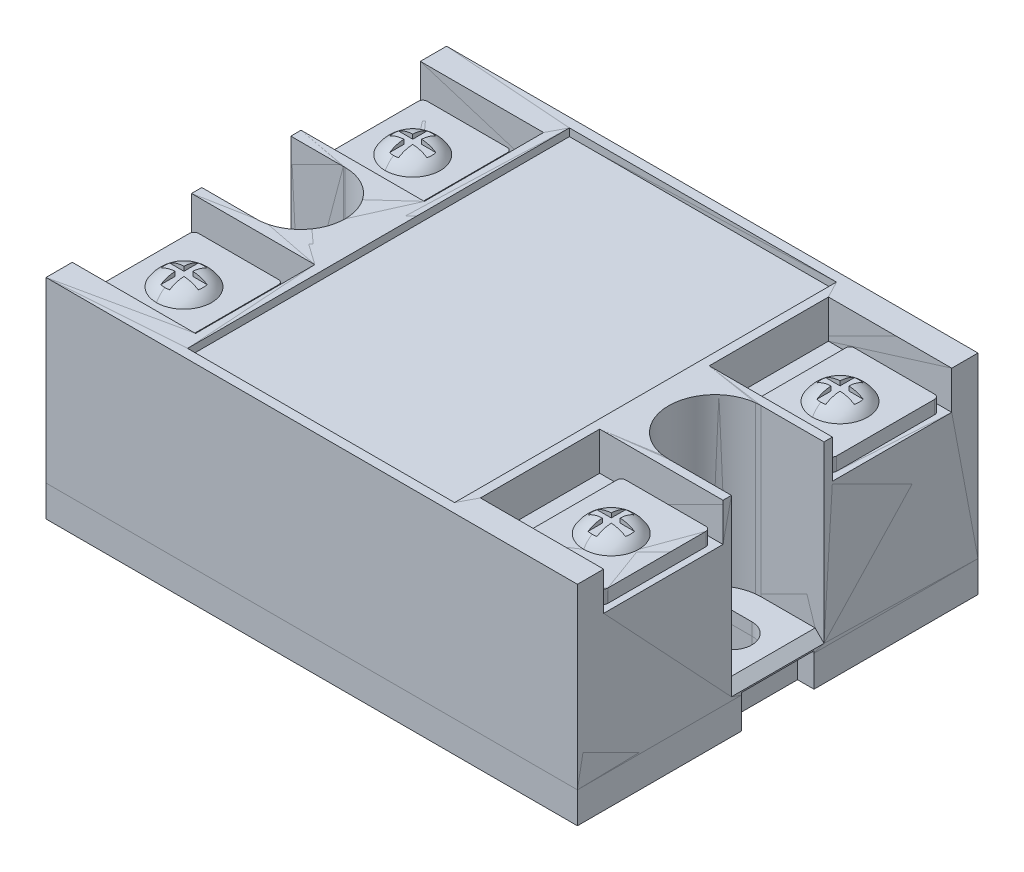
SolidWorks part; units mm, degrees
ref_plane "Ebene vorne" through (0, 0, 0) normal (0, 0, 1) x (1, 0, 0)
ref_plane "Ebene oben" through (0, 0, 0) normal (0, 1, 0) x (1, 0, 0)
ref_plane "Ebene rechts" through (0, 0, 0) normal (1, 0, 0) x (0, 0, -1)
imported_body "Relay.STEP<1>"
sketch "Skizze1" plane through (0, 22.55, 0) normal (0, 1, 0) x (1, 0, 0)
  line L1 (-15, 21.45) -> (15, 21.45)
  line L2 (-15, 21.45) -> (-15, -21.45)
  line L3 (-15, -21.45) -> (15, -21.45)
  line L4 (15, 21.45) -> (15, -21.45)
extrude "Aufsatz-Linear austragen1" add sketch "Skizze1" along normal blind 0.1
